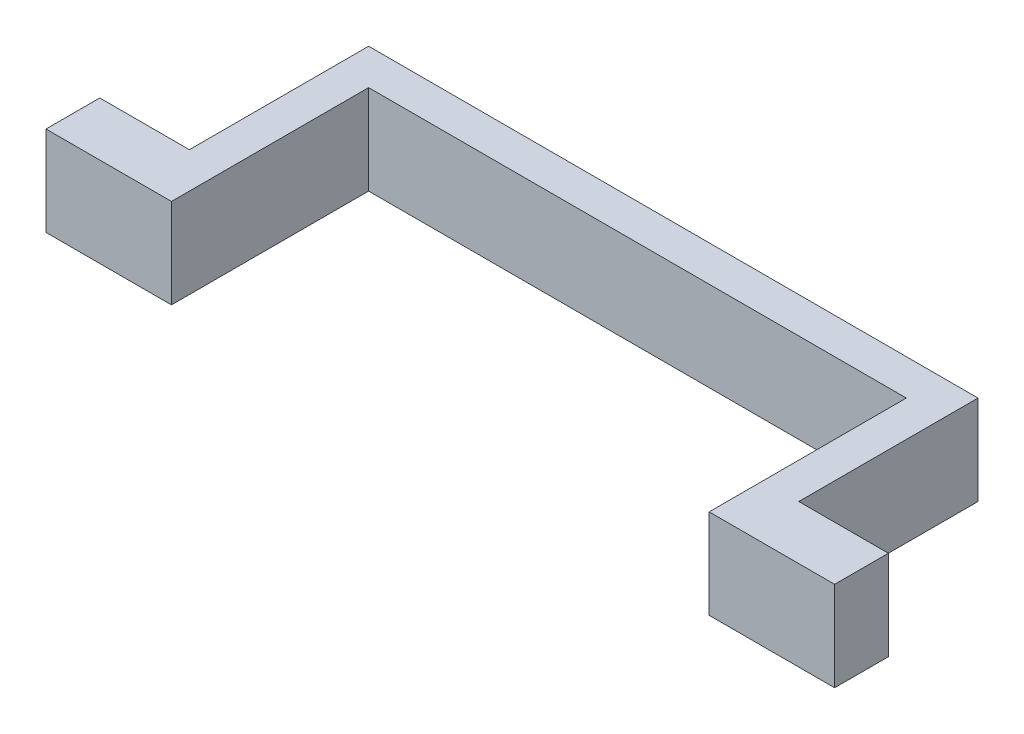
SolidWorks part; units mm, degrees
ref_plane "Alzado" through (0, 0, 0) normal (0, 0, 1) x (1, 0, 0)
ref_plane "Planta" through (0, 0, 0) normal (0, 1, 0) x (1, 0, 0)
ref_plane "Vista lateral" through (0, 0, 0) normal (1, 0, 0) x (0, 0, -1)
sketch "Croquis1" plane through (0, 0, 0) normal (0, 0, 1) x (1, 0, 0)
  line L1 (11.3973, -8.5108) -> (45.3973, -8.5108)
  line L2 (11.3973, -8.5108) -> (11.3973, -3.5108)
  line L3 (11.3973, -3.5108) -> (45.3973, -3.5108)
  line L4 (45.3973, -8.5108) -> (45.3973, -3.5108)
  dimension "D1" = 5
  dimension "D2" = 34
extrude "Saliente-Extruir1" add sketch "Croquis1" along normal blind 2
sketch "Croquis2" plane through (0, 0, 2) normal (0, 0, 1) x (1, 0, 0)
  line L0 (11.3973, -8.5108) -> (45.3973, -8.5108) construction
  line L1 (11.3973, -3.5108) -> (13.3973, -3.5108)
  line L2 (11.3973, -3.5108) -> (11.3973, -8.5108)
  line L3 (11.3973, -8.5108) -> (13.3973, -8.5108)
  line L4 (13.3973, -3.5108) -> (13.3973, -8.5108)
  line L5 (45.3973, -3.5108) -> (11.3973, -3.5108) construction
  line L6 (45.3973, -8.5108) -> (43.3973, -8.5108)
  line L7 (45.3973, -8.5108) -> (45.3973, -3.5108)
  line L8 (45.3973, -3.5108) -> (43.3973, -3.5108)
  line L9 (43.3973, -8.5108) -> (43.3973, -3.5108)
  dimension "D1" = 2
  dimension "D2" = 2
extrude "Saliente-Extruir2" add sketch "Croquis2" along normal blind 11
sketch "Croquis3" plane through (0, 0, 13) normal (0, 0, 1) x (1, 0, 0)
  line L1 (11.3973, -3.5108) -> (6.3973, -3.5108)
  line L2 (11.3973, -3.5108) -> (11.3973, -8.5108)
  line L3 (11.3973, -8.5108) -> (6.3973, -8.5108)
  line L4 (6.3973, -3.5108) -> (6.3973, -8.5108)
  line L5 (45.3973, -3.5108) -> (50.3973, -3.5108)
  line L6 (45.3973, -3.5108) -> (45.3973, -8.5108)
  line L7 (45.3973, -8.5108) -> (50.3973, -8.5108)
  line L8 (50.3973, -3.5108) -> (50.3973, -8.5108)
  dimension "D1" = 5
  dimension "D2" = 5
  dimension "D3" = 5
  dimension "D4" = 5
extrude "Saliente-Extruir3" add sketch "Croquis3" against normal blind 3
